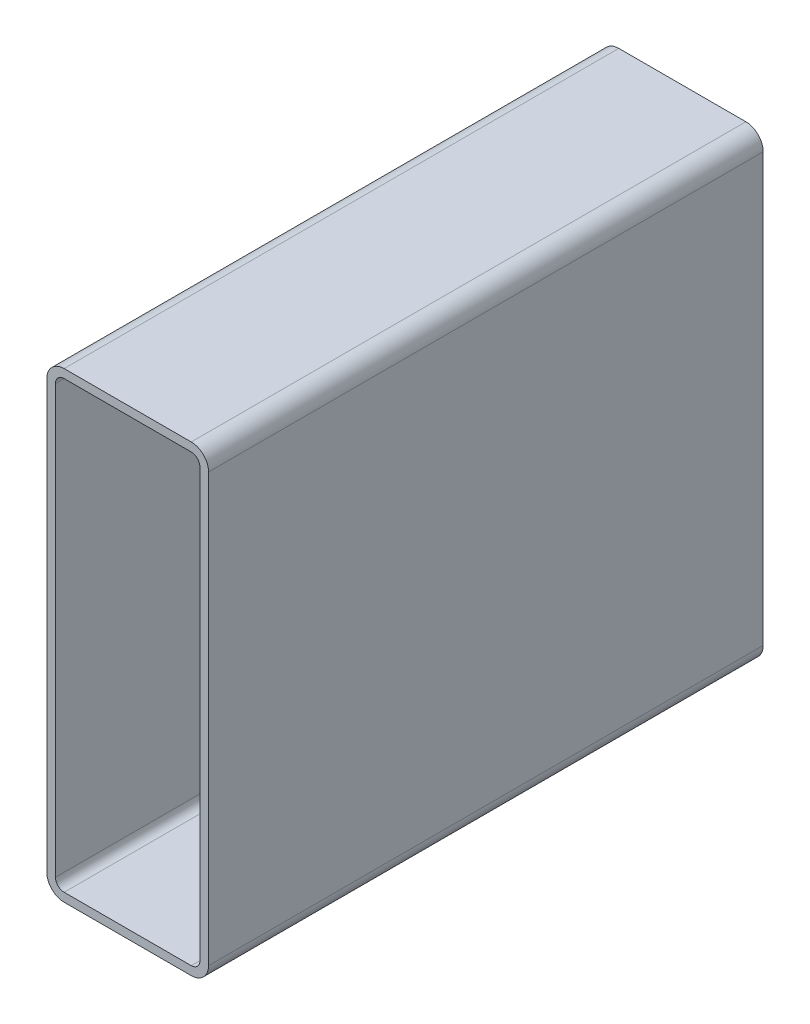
SolidWorks part; units mm, degrees
ref_plane "Front Plane" through (0, 0, 0) normal (0, 0, 1) x (1, 0, 0)
ref_plane "Top Plane" through (0, 0, 0) normal (0, 1, 0) x (1, 0, 0)
ref_plane "Right Plane" through (0, 0, 0) normal (1, 0, 0) x (0, 0, -1)
sketch "Sketch1" plane through (0, 0, 0) normal (0, 0, 1) x (1, 0, 0)
sketch_block_instance "HSS10x3.5x0.1875-1"
sketch_block "HSS10x3.5x0.1875"
extrude "Boss-Extrude1" add sketch "Sketch1" along normal blind 304.8
